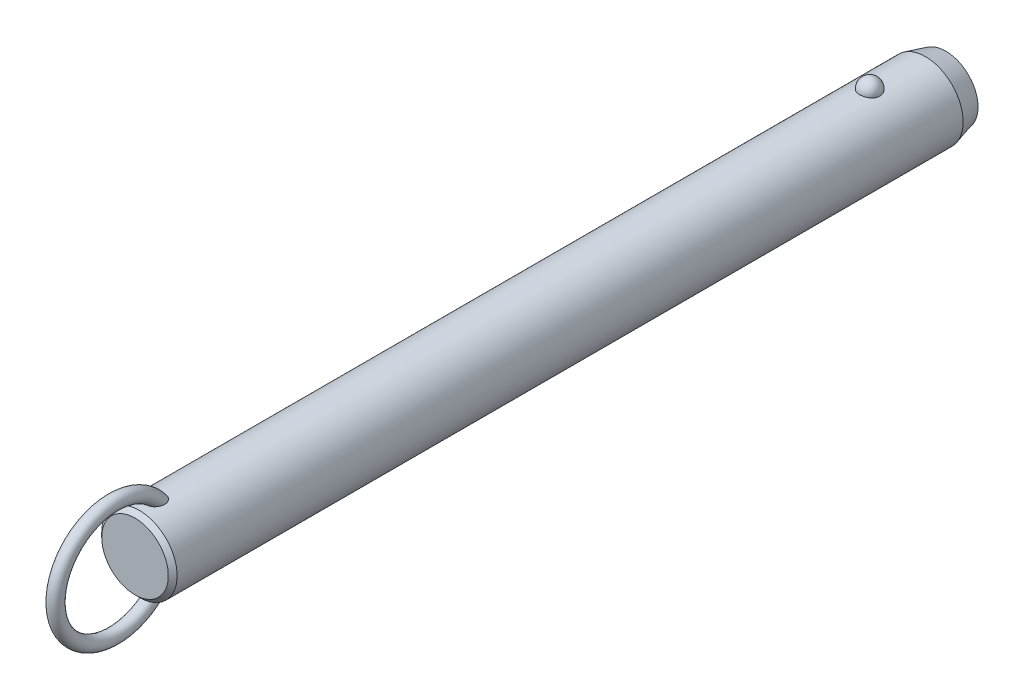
SolidWorks part; units mm, degrees
ref_plane "Front Plane" through (0, 0, 0) normal (0, 0, 1) x (1, 0, 0)
ref_plane "Top Plane" through (0, 0, 0) normal (0, 1, 0) x (1, 0, 0)
ref_plane "Right Plane" through (0, 0, 0) normal (1, 0, 0) x (0, 0, -1)
sketch "Sketch2" plane through (0, 0, 0) normal (0, 0, 1) x (1, 0, 0)
  circle A0 centre (0, 0) radius 11.1
  point P3 (0, 11.1)
  dimension "D1" = 22.2
extrude "Boss-Extrude1" add sketch "Sketch2" along normal blind 200.6
sketch "Sketch3" plane through (0, 0, 0) normal (0, 0, -1) x (-1, 0, 0)
  circle A0 centre (0, 0) radius 11.1
  dimension "D1" = 22.2
extrude "Boss-Extrude2" add sketch "Sketch3" along normal blind 25.4
chamfer "Chamfer1" distance 6 angle 15 1 edges at (-11.1, 0, -25.4)
sketch "Sketch12" plane through (0, 0, 0) normal (1, 0, 0) x (0, 0, -1)
  line L0 (-200.6, 11.1) -> (-200.6, -11.1) construction
  point P0 (-200.6, 0)
sketch "Sketch13" plane through (0, 0, 0) normal (1, 0, 0) x (0, 0, -1)
  circle A0 centre (-219.65, 0) radius 19.05
  point P2 (-200.6, 0)
  dimension "D1" = 38.1
sketch "Sketch14" plane through (0, 0, 0) normal (0, 1, 0) x (1, 0, 0)
  circle A0 centre (0, -202.6) radius 2
  point P2 (0, -200.6)
  dimension "D1" = 4
sweep "Sweep1" add profiles "Sketch14" path "Sketch13"
sketch "Sketch15" plane through (0, 0, 200.6) normal (0, 0, 1) x (1, 0, 0)
  circle A0 centre (0, 0) radius 11.1
  dimension "D1" = 22.2
extrude "Boss-Extrude3" add sketch "Sketch15" along normal blind 12.7
chamfer "Chamfer2" distance 1.3 angle 45 1 edges at (11.1, 0, 213.3)
sketch "Sketch18" plane through (0, 0, 0) normal (1, 0, 0) x (0, 0, -1)
  line L0 (19.4, 11.1) -> (-204.168, 11.1) construction
  line L1 (3, 14.1) -> (3, 8.1)
  line L2 (-204.168, -11.1) -> (19.4, -11.1) construction
  arc A0 (3, 14.1) -> (3, 8.1) centre (3, 11.1) ccw
  point P4 (0, 11.1)
  dimension "D1" = 25.2
revolve "Revolve1" add sketch "Sketch18" angle 360 about L1
